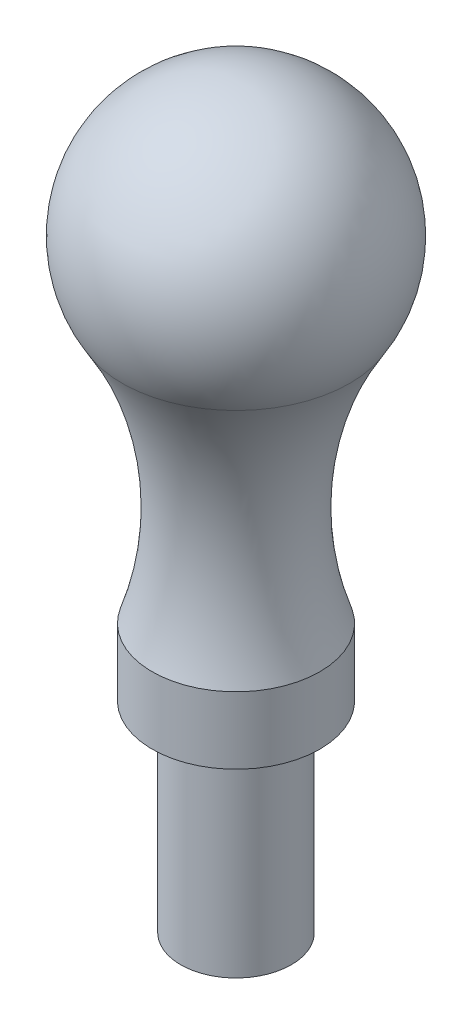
SolidWorks part; units mm, degrees
ref_plane "前视基准面" through (0, 0, 0) normal (0, 0, 1) x (1, 0, 0)
ref_plane "上视基准面" through (0, 0, 0) normal (0, 1, 0) x (1, 0, 0)
ref_plane "右视基准面" through (0, 0, 0) normal (1, 0, 0) x (0, 0, -1)
sketch "草图1" plane through (0, 0, 0) normal (0, 0, 1) x (1, 0, 0)
  line L0 (-7, 49.0086) -> (-8.65, 49.0086) construction
  line L1 (-8.65, 49.0086) -> (-8.65, 55) construction
  line L2 (-8.65, 55) -> (-9.5, 55) construction
  line L3 (-9.5, 55) -> (-9.5, 57) construction
  line L4 (-7, 49.0086) -> (-8.65, 49.0086)
  line L5 (-8.65, 49.0086) -> (-8.65, 55)
  line L6 (-8.65, 55) -> (-9.5, 55)
  line L7 (-9.5, 55) -> (-9.5, 57)
  line L8 (-7, 49.0086) -> (-7, 64.5711) construction
  line L9 (-7, 46.0086) -> (-7, 67.0086) construction
  line L10 (-7, 71.0086) -> (-7, 49.0086)
  arc A0 (-7, 71.0086) -> (-10.3971, 64.8968) centre (-7, 67.0086) ccw construction
  arc A1 (-9.5, 57) -> (-10.3971, 64.8968) centre (-18.269, 60.0032) ccw construction
  arc A2 (-7, 71.0086) -> (-10.3971, 64.8968) centre (-7, 67.0086) ccw
  arc A3 (-9.5, 57) -> (-10.3971, 64.8968) centre (-18.269, 60.0032) ccw
revolve "旋转1" add sketch "草图1" angle 360 about L8
